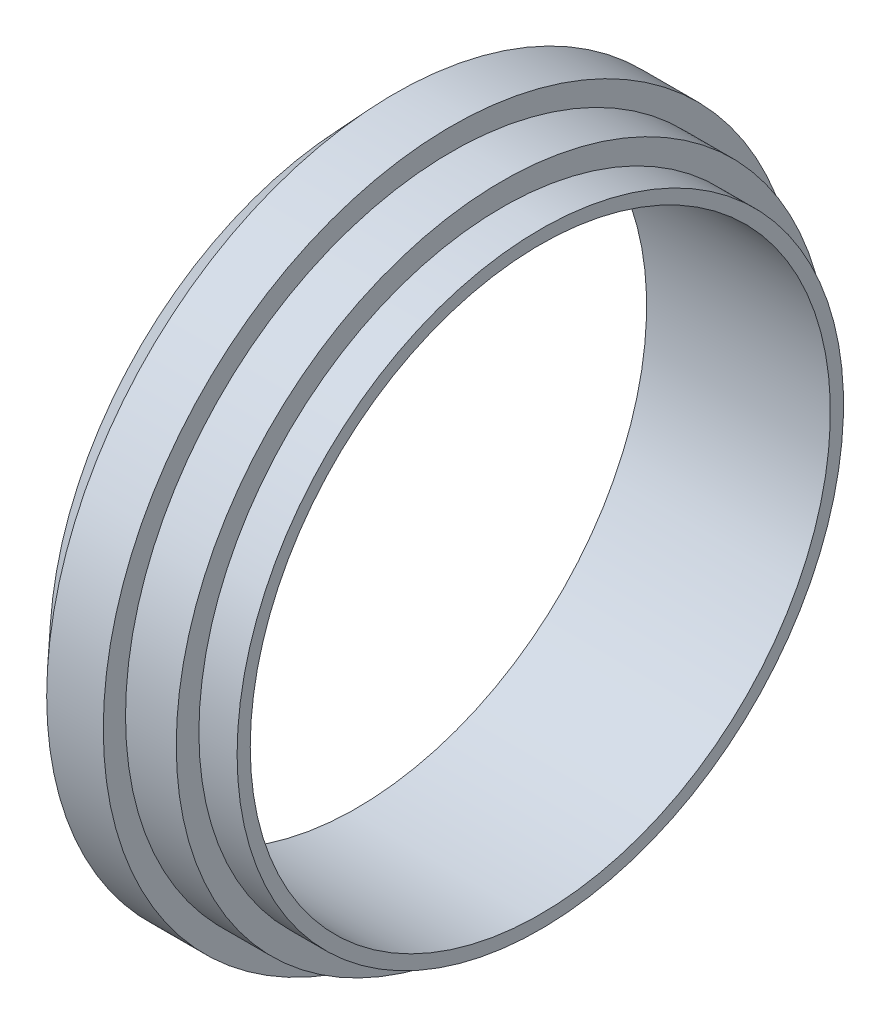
SolidWorks part; units mm, degrees
ref_plane "Front Plane" through (0, 0, 0) normal (0, 0, 1) x (1, 0, 0)
ref_plane "Top Plane" through (0, 0, 0) normal (0, 1, 0) x (1, 0, 0)
ref_plane "Right Plane" through (0, 0, 0) normal (1, 0, 0) x (0, 0, -1)
sketch "Sketch1" plane through (0, 0, 0) normal (0, 0, 1) x (1, 0, 0)
  line L0 (0, 0) -> (-4.8006, 0)
  line L1 (-4.8006, 0) -> (-4.8006, -2.8448)
  line L2 (-4.8006, -2.8448) -> (-11.176, -2.8448)
  line L3 (-11.176, -2.8448) -> (-11.176, -5.6388)
  line L4 (-11.176, -5.6388) -> (-18.288, -5.6388)
  line L5 (-18.288, -5.6388) -> (-23.0886, -0.4826)
  line L6 (-23.0886, -0.4826) -> (-23.0886, 38.1)
  line L7 (-23.0886, 38.1) -> (0, 38.1)
  line L8 (0, 38.1) -> (0, 0)
  dimension "D1" = 38.1
  dimension "D2" = 4.8006
  dimension "D3" = 11.9126
  dimension "D4" = 18.288
  dimension "D5" = 23.0886
  dimension "D6" = 38.5826
  dimension "D7" = 43.7388
  dimension "D8" = 40.9448
revolve "Revolve1" add sketch "Sketch1" angle 360 about L7
sketch "Sketch4" plane through (-23.0886, 0, 0) normal (-1, 0, 0) x (0, 0, 1)
  circle A0 centre (0, 38.1) radius 36.449
extrude "Cut-Extrude1" cut sketch "Sketch4" against normal through all contours A0
